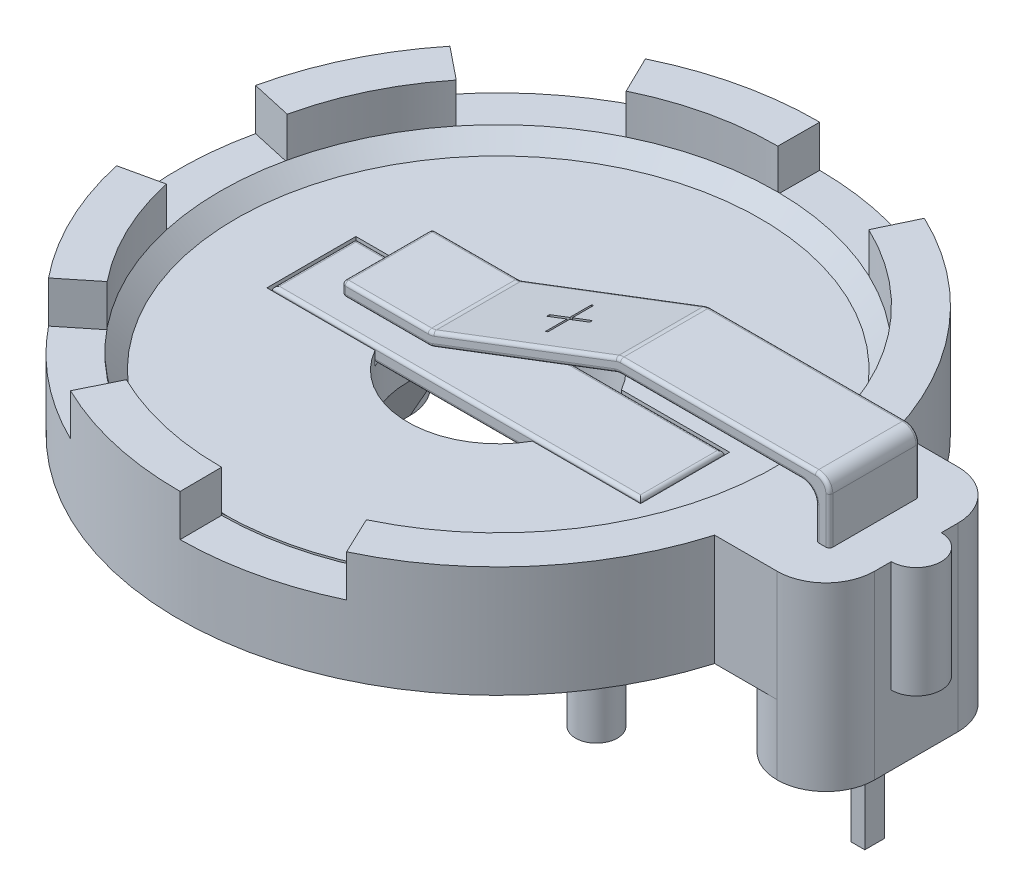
SolidWorks part; units mm, degrees
ref_plane "Front Plane" through (0, 0, 0) normal (0, 0, 1) x (1, 0, 0)
ref_plane "Top Plane" through (0, 0, 0) normal (0, 1, 0) x (1, 0, 0)
ref_plane "Right Plane" through (0, 0, 0) normal (1, 0, 0) x (0, 0, -1)
sketch "Sketch3" plane through (0, 0, 0) normal (0, 1, 0) x (1, 0, 0)
  line L0 (0, 0) -> (24.2923, 0) construction
  line L1 (11.0312, 3.25) -> (11.0312, -3.25) construction
  line L2 (15.0312, -3.25) -> (11.0312, -3.25)
  line L3 (15.0312, -3.25) -> (15.0312, 3.25)
  line L4 (15.0312, 3.25) -> (11.0312, 3.25)
  line L5 (0, -11.5) -> (0, 11.5) construction
  line L6 (15.0312, -3.25) -> (11.0312, 3.25) construction
  line L7 (15.0312, 3.25) -> (11.0312, -3.25) construction
  circle A0 centre (0, 0) radius 11.5 construction
  arc A1 (11.0312, 3.25) -> (11.0312, -3.25) centre (0, 0) ccw
  circle A2 centre (0, 0) radius 3.25
  point P3 (13.0312, 0)
  dimension "D1" = 23
  dimension "D4" = 6.5
  dimension "D2" = 4
  dimension "D3" = 6.5
extrude "Boss-Extrude2" add sketch "Sketch3" along normal blind 4
sketch "Sketch7" plane through (0, 4, 0) normal (0, 1, 0) x (1, 0, 0)
  circle A0 centre (0, 0) radius 10
  dimension "D1" = 20
extrude "Cut-Extrude1" cut sketch "Sketch7" against normal blind 2
chamfer "Chamfer3" distance 0.57 angle 45 1 edges at (0, 2, 10)
sketch "Sketch8" plane through (0, 4, 0) normal (0, 1, 0) x (1, 0, 0)
  line L0 (-11.5, 0) -> (-10, 0) construction
  line L1 (-9.7608, 2.1739) -> (-11.225, 2.5) construction
  line L2 (-9.7608, -2.1739) -> (-11.225, -2.5) construction
  line L3 (-11.225, 2.5) -> (-11.225, -2.5) construction
  line L4 (-11.225, 2.5) -> (-9.7608, 2.1739)
  line L5 (-11.225, -2.5) -> (-9.7608, -2.1739)
  line L6 (-5.0441, 10.3348) -> (-4.3862, 8.9867)
  line L7 (-8.9532, 7.2173) -> (-7.7854, 6.2759)
  line L8 (4.9351, 10.3872) -> (4.2914, 9.0324)
  line L9 (0.0605, 11.4998) -> (0.0526, 9.9999)
  line L10 (11.1981, 2.6179) -> (9.7374, 2.2764)
  line L11 (9.0286, 7.1228) -> (7.851, 6.1937)
  line L12 (9.0286, -7.1228) -> (7.851, -6.1937)
  line L13 (11.1981, -2.6179) -> (9.7374, -2.2764)
  line L14 (0.0605, -11.4998) -> (0.0526, -9.9999)
  line L15 (4.9351, -10.3872) -> (4.2914, -9.0324)
  line L16 (-8.9532, -7.2173) -> (-7.7854, -6.2759)
  line L17 (-5.0441, -10.3348) -> (-4.3862, -8.9867)
  arc A0 (11.0312, 3.25) -> (11.0312, -3.25) centre (0, 0) ccw construction
  circle A2 centre (0, 0) radius 10 construction
  arc A3 (-9.7608, 2.1739) -> (-9.7608, -2.1739) centre (0, 0) ccw
  arc A4 (-11.225, 2.5) -> (-11.225, -2.5) centre (0, 0) ccw
  arc A5 (-4.3862, 8.9867) -> (-7.7854, 6.2759) centre (0, 0) ccw
  arc A6 (-5.0441, 10.3348) -> (-8.9532, 7.2173) centre (0, 0) ccw
  arc A7 (4.2914, 9.0324) -> (0.0526, 9.9999) centre (0, 0) ccw
  arc A8 (4.9351, 10.3872) -> (0.0605, 11.4998) centre (0, 0) ccw
  arc A9 (9.7374, 2.2764) -> (7.851, 6.1937) centre (0, 0) ccw
  arc A10 (11.1981, 2.6179) -> (9.0286, 7.1228) centre (0, 0) ccw
  arc A11 (7.851, -6.1937) -> (9.7374, -2.2764) centre (0, 0) ccw
  arc A12 (9.0286, -7.1228) -> (11.1981, -2.6179) centre (0, 0) ccw
  arc A13 (0.0526, -9.9999) -> (4.2914, -9.0324) centre (0, 0) ccw
  arc A14 (0.0605, -11.4998) -> (4.9351, -10.3872) centre (0, 0) ccw
  arc A15 (-7.7854, -6.2759) -> (-4.3862, -8.9867) centre (0, 0) ccw
  arc A16 (-8.9532, -7.2173) -> (-5.0441, -10.3348) centre (0, 0) ccw
  dimension "D1" = 5
  dimension "D2" = 7
extrude "Cut-Extrude2" cut sketch "Sketch8" against normal blind 1.5
sketch "Sketch9" plane through (0, 0, 0) normal (0, -1, 0) x (1, 0, 0)
  line L1 (15.0312, -3.25) -> (11.0312, -3.25) construction
  line L2 (15.0312, 3.25) -> (11.5312, 3.25)
  line L3 (15.0312, 3.25) -> (15.0312, -3.25)
  line L4 (15.0312, -3.25) -> (11.5312, -3.25)
  line L6 (11.5312, 3.25) -> (11.5312, -3.25)
  line L7 (0, 0) -> (-7.9407, 0) construction
  line L8 (0, 11.5) -> (0, -11.5) construction
  line L9 (-8.1688, 3.25) -> (-4.6688, 3.25)
  line L10 (-8.1688, 3.25) -> (-8.1688, -3.25)
  line L11 (-8.1688, -3.25) -> (-4.6688, -3.25)
  line L12 (-4.6688, 3.25) -> (-4.6688, -3.25)
  line L13 (-8.1688, 3.25) -> (-4.6688, -3.25) construction
  line L14 (-8.1688, -3.25) -> (-4.6688, 3.25) construction
  arc A0 (11.0312, 3.25) -> (11.0312, -3.25) centre (0, 0) ccw construction
  circle A1 centre (0, -9.65) radius 0.75
  circle A2 centre (-8.3571, 4.825) radius 0.75
  circle A3 centre (8.3571, 4.825) radius 0.75
  point P9 (-6.4188, 0)
  dimension "D5" = 1.5
  dimension "D1" = 3.5
  dimension "D2" = 3.5
  dimension "D3" = 23.2
  dimension "D4" = 6.5
  dimension "D6" = 1.85
  dimension "D7" = 3
extrude "Boss-Extrude6" add sketch "Sketch9" along normal blind 2.5
fillet "Fillet1" radius 1.75 8 edges at (15.0312, 0.75, -3.25) (15.0312, 0.75, 3.25) (-4.6688, -1.25, -3.25) (-8.1688, -1.25, -3.25) (-4.6688, -1.25, 3.25) (-8.1688, -1.25, 3.25)
sketch "Sketch10" plane through (0, 0, 0) normal (0, 0, 1) x (1, 0, 0)
  line L1 (11.5312, -2.5) -> (13.2812, -2.5) construction
  line L3 (11.5312, 0) -> (10.2312, 0) construction
  line L4 (11.5312, 0) -> (11.5312, -2.5) construction
  line L5 (11.5312, -2.5) -> (10.2312, -2.5) construction
  line L6 (10.2312, 0) -> (10.2312, -2.5) construction
  line L7 (10.2312, 0) -> (11.5312, -2.5)
  dimension "D1" = 1.3
rib "Rib1" sketch "Sketch10" sketch "Sketch10" thickness 3 extrusion direction parallel to sketch draft on no parameters "D1"=3
sketch "Sketch12" plane through (0, 0, 0) normal (0, 0, 1) x (1, 0, 0)
  line L0 (-6.4188, -2.5) -> (-4.6688, -2.5) construction
  line L1 (-3.25, 0) -> (-4.6688, 0) construction
  line L2 (-3.25, 0) -> (-3.25, -2.5) construction
  line L3 (-3.25, -2.5) -> (-4.6688, -2.5) construction
  line L4 (-4.6688, 0) -> (-4.6688, -2.5) construction
  line L5 (-4.6688, 0) -> (-4.6688, -2.5) construction
  line L6 (-3.25, 0) -> (-4.6688, -2.5)
rib "Rib2" sketch "Sketch12" sketch "Sketch12" thickness 3 extrusion direction parallel to sketch draft on no parameters "D1"=3
sketch "Sketch13" plane through (0, -2.5, 0) normal (0, -1, 0) x (1, 0, 0)
  line L0 (13.2812, 3.25) -> (13.2812, -3.25) construction
  line L1 (15.0312, 0) -> (-8.1688, 0) construction
  line L2 (15.0312, -1.5) -> (15.0312, 1.5) construction
  line L3 (-8.1688, 1.5) -> (-8.1688, -1.5) construction
  line L4 (-6.9688, 0.35) -> (-6.4688, 0.35)
  line L5 (13.0312, 0.35) -> (13.5312, 0.35)
  line L6 (13.0312, 0.35) -> (13.0312, -0.35)
  line L7 (13.0312, -0.35) -> (13.5312, -0.35)
  line L8 (13.5312, 0.35) -> (13.5312, -0.35)
  line L9 (13.0312, 0.35) -> (13.5312, -0.35) construction
  line L10 (13.0312, -0.35) -> (13.5312, 0.35) construction
  line L11 (-6.9688, -0.35) -> (-6.4688, -0.35)
  line L12 (-6.4688, 0.35) -> (-6.4688, -0.35)
  line L13 (-6.9688, 0.35) -> (-6.9688, -0.35)
  line L14 (-6.9688, -0.35) -> (-6.4688, 0.35) construction
  line L15 (-6.9688, 0.35) -> (-6.4688, -0.35) construction
  point P10 (13.2812, 0)
  point P15 (-6.7188, 0)
  dimension "D1" = 0.7
  dimension "D2" = 0.5
  dimension "D3" = 2
extrude "Boss-Extrude7" add sketch "Sketch13" along normal blind 3.5 separate body
sketch "Sketch14" plane through (0, 2, 0) normal (0, 1, 0) x (1, 0, 0)
  line L0 (-6.9688, 0.35) -> (-6.4688, 0.35) construction
  line L1 (-6.9688, -0.35) -> (-6.9688, 0.35) construction
  line L2 (-6.4688, -0.35) -> (-6.9688, -0.35) construction
  line L3 (-6.4688, 0.35) -> (-6.4688, -0.35) construction
  line L8 (-6.9688, 0.35) -> (-6.4688, 0.35) construction
  line L9 (-6.9688, -0.35) -> (-6.9688, 0.35) construction
  line L10 (-6.4688, -0.35) -> (-6.9688, -0.35) construction
  line L11 (-6.4688, 0.35) -> (-6.4688, -0.35) construction
  line L12 (-6.9688, 0.35) -> (-6.4688, -0.35) construction
  line L13 (2.8289, 1.6) -> (6.7189, 1.6)
  line L14 (2.8289, 1.6) -> (2.8289, -1.6) construction
  line L15 (2.8289, -1.6) -> (6.7189, -1.6)
  line L16 (-11.5, 0) -> (15.0312, 0) construction
  line L17 (15.0312, -1.5) -> (15.0312, 1.5) construction
  line L18 (6.7189, 1.6) -> (6.7189, -1.6)
  line L19 (2.8289, 1.6) -> (6.7189, -1.6) construction
  line L20 (2.8289, -1.6) -> (6.7189, 1.6) construction
  line L21 (-6.7188, 1.6) -> (-2.8289, 1.6)
  line L22 (-6.7188, 1.6) -> (-6.7188, -1.6)
  line L23 (-6.7188, -1.6) -> (-2.8289, -1.6)
  line L24 (-2.8289, 1.6) -> (-2.8289, -1.6) construction
  line L25 (-6.7188, 1.6) -> (-2.8289, -1.6) construction
  line L26 (-6.7188, -1.6) -> (-2.8289, 1.6) construction
  line L27 (-6.9688, -0.35) -> (-6.4688, 0.35) construction
  arc A0 (-11.225, 2.5) -> (-11.225, -2.5) centre (0, 0) ccw construction
  circle A1 centre (0, 0) radius 3.25 construction
  arc A2 (-2.8289, 1.6) -> (-2.8289, -1.6) centre (0, 0) ccw
  arc A3 (2.8289, -1.6) -> (2.8289, 1.6) centre (0, 0) ccw
  point P4 (4.7739, 0)
  point P18 (-4.7738, 0)
  point P23 (-6.7188, 0)
  dimension "D1" = 3.2
  dimension "D2" = 3.89
  dimension "D3" = 3.2
extrude "Cut-Extrude3" cut sketch "Sketch14" against normal blind 0.5
sketch "Sketch15" plane through (0, 1.5, 0) normal (0, 1, 0) x (1, 0, 0)
  line L0 (-2.8289, 1.6) -> (-6.7188, 1.6) construction
  line L1 (-6.6188, 1.5) -> (6.6189, 1.5)
  line L2 (-6.6188, 1.5) -> (-6.6188, -1.5)
  line L3 (-6.6188, -1.5) -> (6.6189, -1.5)
  line L4 (6.6189, 1.5) -> (6.6189, -1.5)
  line L5 (-6.7188, 1.6) -> (-6.7188, -1.6) construction
  line L6 (-6.7188, -1.6) -> (-2.8289, -1.6) construction
  line L7 (6.7189, -1.6) -> (6.7189, 1.6) construction
  dimension "D1" = 0.1
  dimension "D2" = 0.1
  dimension "D3" = 0.1
  dimension "D4" = 0.1
extrude "Boss-Extrude8" add sketch "Sketch15" along normal blind 0.55 separate body
sketch "Sketch16" plane through (0, 0, 0) normal (0, 0, 1) x (1, 0, 0)
  line L0 (13.5312, -6) -> (13.0312, -6) construction
  line L1 (13.5312, -6) -> (13.0312, -6) construction
  line L2 (13.2812, -6) -> (13.2812, 9.6729) construction
  line L3 (13.2812, 5.67) -> (5.9312, 5.67) construction
  line L4 (13.2812, 6.17) -> (5.9312, 6.17)
  line L5 (11.0312, 4) -> (13.2812, 4) construction
  line L6 (5.9312, 6.17) -> (-0.799, 3.6118)
  line L7 (13.5312, 4) -> (13.0312, 4)
  line L8 (13.5312, 4) -> (13.5312, 6.17)
  line L9 (13.5312, 6.17) -> (13.0312, 6.17) construction
  line L10 (13.0312, 4) -> (13.0312, 6.17) construction
  line L11 (13.5312, 4) -> (13.0312, 6.17) construction
  line L12 (13.5312, 6.17) -> (13.0312, 4) construction
  line L13 (5.9312, 5.67) -> (-0.799, 3.1118)
  line L14 (-0.799, 3.6118) -> (-3.999, 3.6118)
  line L15 (-3.999, 3.6118) -> (-3.999, 3.1118)
  line L16 (-3.999, 3.1118) -> (-0.799, 3.1118)
  line L17 (5.9312, 5.67) -> (13.0312, 5.67)
  line L18 (13.0312, 5.67) -> (13.0312, 4)
  line L20 (13.2812, 6.17) -> (13.5312, 6.17)
  point P10 (12.1562, 4)
  point P11 (13.2812, 5.085)
  dimension "D1" = 1.67
  dimension "D2" = 0.5
  dimension "D3" = 0.5
  dimension "D4" = 7.6
  dimension "D5" = 0.5
  dimension "D6" = 7.2
  dimension "D7" = 0.5
  dimension "D8" = 3.2
  dimension "D9" = 20.812
  dimension "D10" = 20.812
extrude "Boss-Extrude9" add sketch "Sketch16" along normal mid plane 3.25 separate body
fillet "Fillet2" radius 0.5 6 edges at (-0.799, 3.1118, 0) (-0.799, 3.6118, 0) (5.9312, 5.67, 0) (5.9312, 6.17, 0) (13.0312, 5.67, 0) (13.5312, 6.17, 0)
fillet "Fillet3" radius 0.125 32 edges at (13.0312, 4.585, 1.625) (12.8848, 5.5236, 1.625) (9.2771, 5.67, 1.625) (5.9327, 5.6618, 1.625) (2.5661, 4.3909, 1.625) (-0.8005, 3.1201, 1.625) (13.0312, 4.585, -1.625) (12.8848, 5.5236, -1.625) (9.2771, 5.67, -1.625) (5.9327, 5.6618, -1.625) (2.5661, 4.3909, -1.625) (-0.8005, 3.1201, -1.625) (13.5312, 4.835, -1.625) (13.3848, 6.0236, -1.625) (9.5271, 6.17, -1.625) (5.9327, 6.1618, -1.625) (2.5661, 4.8909, -1.625) (-0.8005, 3.6201, -1.625) (13.5312, 4.835, 1.625) (13.3848, 6.0236, 1.625) (9.5271, 6.17, 1.625) (5.9327, 6.1618, 1.625) (2.5661, 4.8909, 1.625) (-0.8005, 3.6201, 1.625) (-3.999, 3.1118, 0) (-2.4449, 3.1118, 1.625) (-2.4449, 3.1118, -1.625) (-3.999, 3.6118, 0) (-2.4449, 3.6118, -1.625) (-2.4449, 3.6118, 1.625) (-3.999, 3.3618, -1.625) (-3.999, 3.3618, 1.625)
fillet "Fillet4" radius 0.125 8 edges at (0, 1.5, 1.5) (6.6189, 1.5, 0) (0, 1.5, -1.5) (-6.6188, 1.5, 0) (0, 2.05, -1.5) (6.6189, 2.05, 0) (0, 2.05, 1.5) (-6.6188, 2.05, 0)
sketch "Sketch18" plane through (-1.3004, 3.4213, 0) normal (-0.3553, 0.9348, 0) x (0.9348, 0.3553, 0)
  line L0 (-999.3718, 0) -> (49000.6282, 0) construction
  line L1 (0.6282, 1.5) -> (0.6282, -1.5) construction
  line L2 (4.1364, -998.5) -> (4.1364, 49001.5) construction
  line L3 (7.6446, 1.5) -> (0.6282, 1.5) construction
  line L4 (4.0864, 0.05) -> (3.3114, 0.05)
  line L5 (4.0864, 0.825) -> (4.1864, 0.825) construction
  line L6 (4.0864, 0.825) -> (4.0864, -0.825) construction
  line L7 (4.0864, -0.825) -> (4.1864, -0.825) construction
  line L8 (4.1864, 0.825) -> (4.1864, -0.825) construction
  line L9 (4.0864, 0.825) -> (4.1864, -0.825) construction
  line L10 (4.0864, -0.825) -> (4.1864, 0.825) construction
  line L11 (3.3114, 0.05) -> (4.9614, 0.05) construction
  line L12 (3.3114, 0.05) -> (3.3114, -0.05) construction
  line L13 (3.3114, -0.05) -> (4.9614, -0.05) construction
  line L14 (4.9614, 0.05) -> (4.9614, -0.05) construction
  line L15 (3.3114, 0.05) -> (4.9614, -0.05) construction
  line L16 (3.3114, -0.05) -> (4.9614, 0.05) construction
  line L17 (3.3114, 0.05) -> (3.3114, -0.05)
  line L18 (3.3114, -0.05) -> (4.0864, -0.05)
  line L19 (4.0864, -0.05) -> (4.0864, -0.825)
  line L20 (4.0864, -0.825) -> (4.1864, -0.825)
  line L21 (4.1864, -0.825) -> (4.1864, -0.05)
  line L22 (4.9614, 0.05) -> (4.1864, 0.05)
  line L23 (4.1864, 0.05) -> (4.1864, 0.825)
  line L24 (4.1864, 0.825) -> (4.0864, 0.825)
  line L25 (4.0864, 0.825) -> (4.0864, 0.05)
  line L26 (4.9614, 0.05) -> (4.9614, -0.05)
  line L27 (4.9614, -0.05) -> (4.1864, -0.05)
  point P5 (0.6282, 0)
  point P6 (4.1364, 0)
  point P10 (4.1364, 1.5)
  point P15 (4.1364, 0)
  dimension "D1" = 1.65
  dimension "D2" = 1.65
  dimension "D3" = 0.1
  dimension "D4" = 0.1
extrude "Cut-Extrude4" cut sketch "Sketch18" against normal blind 0.125
sketch "Sketch20" plane through (0, 4, 0) normal (0, 1, 0) x (1, 0, 0)
  line L0 (15.0312, -1.5) -> (15.0312, 1.5) construction
  line L1 (15.0312, -1.5) -> (15.0312, 1.5) construction
  line L2 (15.0312, 0.9) -> (15.0312, -0.9)
  arc A0 (15.0312, 0.9) -> (15.0312, -0.9) centre (15.0312, 0) cw
  dimension "D1" = 0.9
extrude "Boss-Extrude10" add sketch "Sketch20" against normal blind 4
